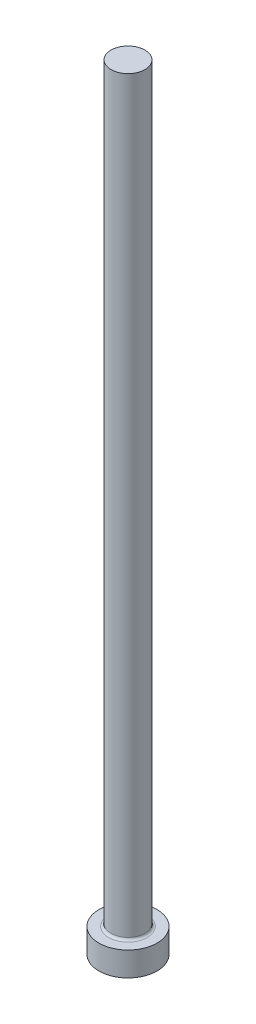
SolidWorks part; units mm, degrees
ref_plane "Plano frontal" through (0, 0, 0) normal (0, 0, 1) x (1, 0, 0)
ref_plane "Plano superior" through (0, 0, 0) normal (0, 1, 0) x (1, 0, 0)
ref_plane "Plano direito" through (0, 0, 0) normal (1, 0, 0) x (0, 0, -1)
sketch "Esboço1" plane through (0, 0, 0) normal (0, 0, 1) x (1, 0, 0)
  line L0 (0, 0) -> (6, 0)
  line L1 (6, 0) -> (6, 5)
  line L2 (6, 5) -> (4, 5)
  line L3 (3.5, 5.5) -> (3.5, 160)
  line L4 (3.5, 160) -> (0, 160)
  line L5 (0, 160) -> (0, 0) construction
  line L6 (0, 0) -> (0, 160)
  arc A0 (4, 5) -> (3.5, 5.5) centre (4, 5.5) cw
  dimension "D3" = 0.5
  dimension "D1" = 12
  dimension "D2" = 7
  dimension "D4" = 5
  dimension "D5" = 160
revolve "Revolução1" add sketch "Esboço1" angle 360 about L5
sketch "Esboço2"
  dimension "D1" = 1.05
  dimension "D2" = 0.675
  dimension "D3" = 3.225
  dimension "D4" = 0.45
wrap "Envolver1" sketch "Esboço2" wrap type deboss source sketch "Esboço2" thickness 0.1 parameters "D1"=0.1
